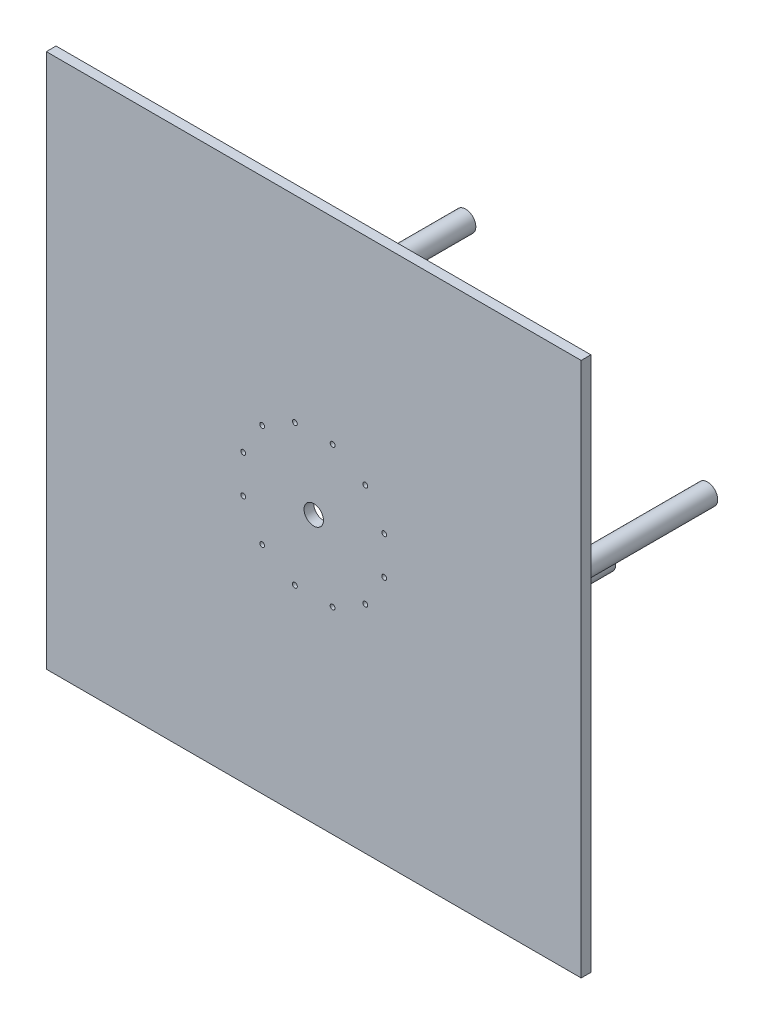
SolidWorks part; units mm, degrees
ref_plane "Face" through (0, 0, 0) normal (0, 0, 1) x (1, 0, 0)
ref_plane "Dessus" through (0, 0, 0) normal (0, 1, 0) x (1, 0, 0)
ref_plane "Droite" through (0, 0, 0) normal (1, 0, 0) x (0, 0, -1)
sketch "Esquisse1" plane through (0, 0, 0) normal (0, 0, 1) x (1, 0, 0)
  line L1 (0, 0) -> (1100, 0)
  line L2 (0, 0) -> (0, 1100)
  line L3 (0, 1100) -> (1100, 1100)
  line L4 (1100, 0) -> (1100, 1100)
  dimension "D2" = 1100
extrude "Base-Extrusion" add sketch "Esquisse1" along normal blind 20
sketch "Esquisse2" plane through (0, 0, 0) normal (0, 0, -1) x (-1, 0, 0)
  line L0 (-550, 550) -> (13.107, 754.9542) construction
  line L1 (-1100, 550) -> (0, 550) construction
  line L2 (-1100, 0) -> (-1100, 1100) construction
  line L3 (0, 1100) -> (0, 0) construction
  circle A0 centre (-268.0922, 652.606) radius 21
  circle A1 centre (-268.0922, 652.606) radius 19
  dimension "D1" = 42
  dimension "D3" = 300
  dimension "D4" = 38
  dimension "D2" = 20
extrude "Boss.-Extru.1" add sketch "Esquisse2" along normal blind 300
sketch "Esquisse3" plane through (0, 0, 0) normal (0, 0, -1) x (-1, 0, 0)
  circle A0 centre (-550, 550) radius 20
  dimension "D1" = 40
extrude "Enlèv. mat.-Extru.1" cut sketch "Esquisse3" against normal through all
sketch "Esquisse5" plane through (0, 0, 0) normal (0, 0, -1) x (-1, 0, 0)
  line L0 (-694.8889, 588.8229) -> (-550, 550) construction
  line L1 (-1100, 550) -> (0, 550) construction
  circle A0 centre (-550, 550) radius 150 construction
  circle A1 centre (-550, 550) radius 20 construction
  circle A2 centre (-694.8889, 588.8229) radius 5
  dimension "D1" = 300
  dimension "D2" = 10
  dimension "D3" = 15
extrude "Enlèv. mat.-Extru.2" cut sketch "Esquisse5" against normal through all
pattern_circular "Répétition circulaire1" count 12 over 360
sketch "Esquisse6" plane through (0, 0, 0) normal (0, 0, -1) x (-1, 0, 0)
  line L0 (-550, 550) -> (-947.9474, 443.3703) construction
  circle A0 centre (-839.7777, 472.3543) radius 21
  circle A1 centre (-839.7777, 472.3543) radius 19
  circle A2 centre (-550, 550) radius 20 construction
  dimension "D1" = 42
  dimension "D2" = 38
  dimension "D3" = 300
extrude "Boss.-Extru.2" add sketch "Esquisse6" along normal blind 500
sketch "Esquisse7" plane through (0, 0, 0) normal (0, 0, -1) x (-1, 0, 0)
  line L0 (-550, 550) -> (-677.5305, 74.0498) construction
  circle A0 centre (-629.9751, 251.5289) radius 21
  circle A1 centre (-550, 550) radius 20 construction
  circle A2 centre (-629.9751, 251.5289) radius 19
  dimension "D1" = 42
  dimension "D2" = 309
  dimension "D3" = 38
extrude "Boss.-Extru.3" add sketch "Esquisse7" along normal blind 500
sketch "Esquisse8" plane through (0, 0, 0) normal (0, 0, -1) x (-1, 0, 0)
  line L0 (-550, 550) -> (-450.3103, 922.0471) construction
  circle A0 centre (-472.3543, 839.7777) radius 21
  circle A1 centre (-472.3543, 839.7777) radius 19
  dimension "D1" = 38
  dimension "D2" = 42
  dimension "D3" = 300
extrude "Boss.-Extru.4" add sketch "Esquisse8" along normal blind 370
sketch "Esquisse9" plane through (0, 0, 0) normal (0, 0, -1) x (-1, 0, 0)
  line L0 (-550, 550) -> (-670.2008, 998.5957) construction
